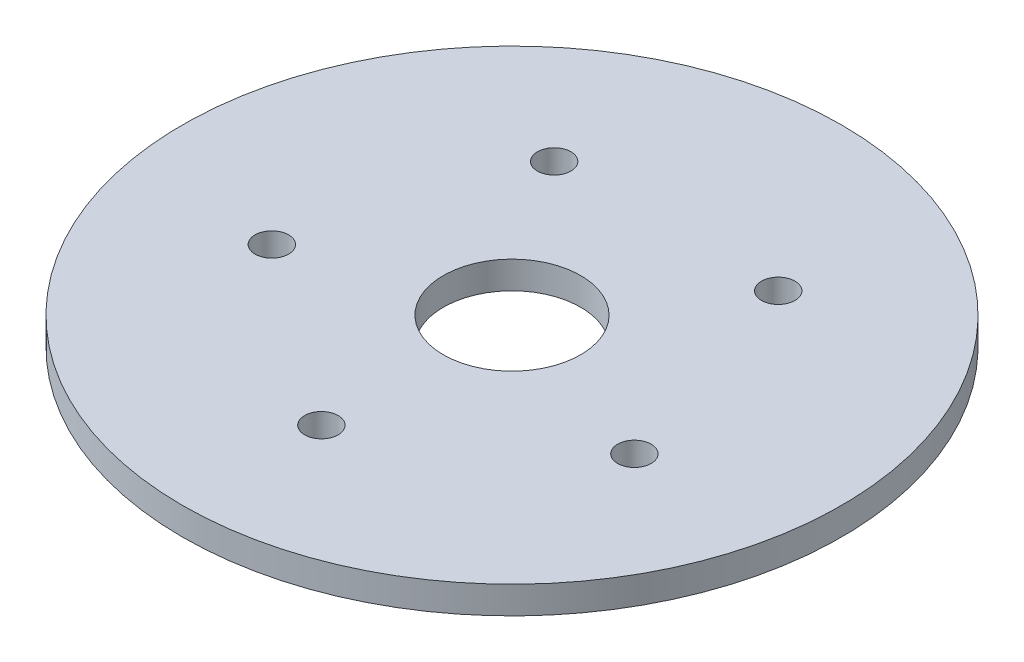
SolidWorks part; units mm, degrees
ref_plane "Front Plane" through (0, 0, 0) normal (0, 0, 1) x (1, 0, 0)
ref_plane "Top Plane" through (0, 0, 0) normal (0, 1, 0) x (1, 0, 0)
ref_plane "Right Plane" through (0, 0, 0) normal (1, 0, 0) x (0, 0, -1)
sketch "Sketch1" plane through (0, 0, 0) normal (0, 1, 0) x (1, 0, 0)
  circle A0 centre (0, 0) radius 152.4
  dimension "D1" = 304.8
extrude "Extrude1" add sketch "Sketch1" along normal blind 12.7
sketch "Sketch2" plane through (0, 12.7, 0) normal (0, 1, 0) x (1, 0, 0)
  circle A0 centre (0, 0) radius 31.75
  dimension "D1" = 63.5
extrude "Cut-Extrude1" cut sketch "Sketch2" against normal blind 12.7
sketch "Sketch3" plane through (0, 0, 0) normal (0, -1, 0) x (1, 0, 0)
  line L0 (0, 0) -> (0, 88.1501) construction
  circle A0 centre (0, 0) radius 88.1501
  dimension "D1" = 176.3002
sketch "Sketch9" plane through (0, 0, 0) normal (0, -1, 0) x (1, 0, 0)
  circle A0 centre (0, 88.1501) radius 7.75
  dimension "D1" = 15.5
extrude "Cut-Extrude2" cut sketch "Sketch9" against normal through all
pattern_circular "CirPattern1" count 5 over 360 about axis through (0, 0, 0) along (0, 1, 0) of "Cut-Extrude2"
